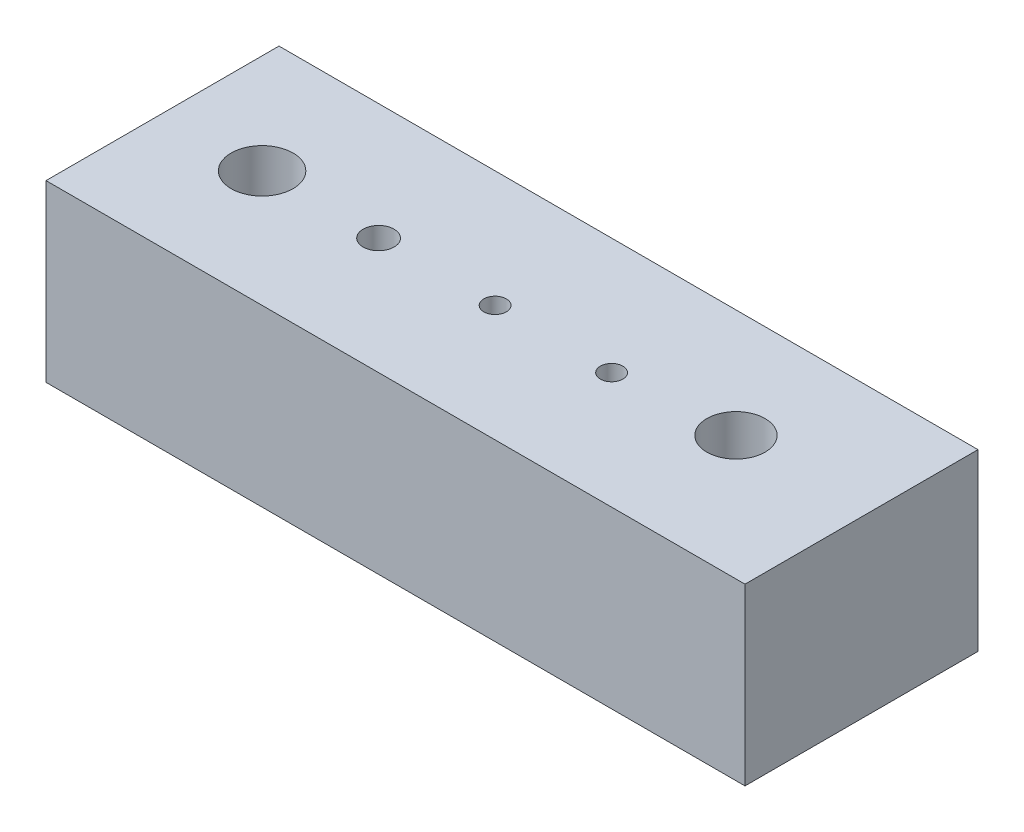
SolidWorks part; units mm, degrees
ref_plane "Front Plane" through (0, 0, 0) normal (0, 0, 1) x (1, 0, 0)
ref_plane "Top Plane" through (0, 0, 0) normal (0, 1, 0) x (1, 0, 0)
ref_plane "Right Plane" through (0, 0, 0) normal (1, 0, 0) x (0, 0, -1)
sketch "Sketch1" plane through (0, 0, 0) normal (0, 1, 0) x (1, 0, 0)
  line L1 (0, 0) -> (152.4, 0)
  line L2 (0, 0) -> (0, 50.8)
  line L3 (0, 50.8) -> (152.4, 50.8)
  line L4 (152.4, 0) -> (152.4, 50.8)
  dimension "D1" = 152.4
  dimension "D2" = 50.8
extrude "Boss-Extrude1" add sketch "Sketch1" along normal blind 38.1
hole_wizard "1/2 Clearance Hole2" positions "Sketch6" profile "Sketch5" hole size "1/2" standard "ANSI Inch"
sketch "Sketch6" plane through (0, 38.1, 0) normal (0, 1, 0) x (1, 0, 0)
  line L0 (0, 50.8) -> (0, 0) construction
  line L1 (152.4, 50.8) -> (0, 50.8) construction
  point P0 (21.717, 25.4)
  point P1 (0, 25.4)
  dimension "D1" = 21.717
  dimension "D2" = 25.4
sketch "Sketch5" plane through (21.717, 38.1, -25.4) normal (1, 0, 0) x (0, 0, 1)
  line L0 (0, 0) -> (0, 38.1)
  line L1 (0, 38.1) -> (6.7462, 38.1)
  line L2 (6.7462, 38.1) -> (6.7462, 0)
  line L5 (6.7462, 0) -> (0, 0)
  line L11 (0, -6.35) -> (0, 107.95) construction
  dimension "Thru Hole Dia." = 13.4925
  dimension "Thru Hole Depth" = 38.1
hole_wizard "1/4 Clearance Hole1" positions "Sketch15" profile "Sketch14" hole size "1/4" standard "ANSI Inch"
sketch "Sketch15" plane through (0, 38.1, 0) normal (0, 1, 0) x (1, 0, 0)
  line L0 (152.4, 50.8) -> (0, 50.8) construction
  circle A0 centre (21.717, 25.4) radius 6.7462 construction
  point P0 (47.117, 25.4)
  dimension "D1" = 25.4
  dimension "D2" = 25.4
sketch "Sketch14" plane through (47.117, 38.1, -25.4) normal (1, 0, 0) x (0, 0, 1)
  line L0 (0, 0) -> (0, 40.1298)
  line L1 (0, 40.1298) -> (3.3782, 38.1)
  line L2 (3.3782, 38.1) -> (3.3782, 0)
  line L5 (3.3782, 0) -> (0, 0)
  line L10 (0, 40.1298) -> (-3.3782, 38.1) construction
  line L11 (0, -6.35) -> (0, 107.95) construction
  dimension "Hole Dia." = 6.7564
  dimension "Hole Depth" = 38.1
  dimension "Drill Angle" = 118
hole_wizard "#10 (0.1935) Diameter Hole1" positions "Sketch13" profile "Sketch12" hole size "#10" standard "ANSI Inch"
sketch "Sketch13" plane through (0, 38.1, 0) normal (0, 1, 0) x (1, 0, 0)
  line L0 (152.4, 50.8) -> (0, 50.8) construction
  circle A0 centre (47.117, 25.4) radius 3.3782 construction
  point P0 (72.517, 25.4)
  dimension "D1" = 25.4
  dimension "D2" = 25.4
sketch "Sketch12" plane through (72.517, 38.1, -25.4) normal (1, 0, 0) x (0, 0, 1)
  line L0 (0, 0) -> (0, 39.5766)
  line L1 (0, 39.5766) -> (2.4574, 38.1)
  line L2 (2.4574, 38.1) -> (2.4574, 0)
  line L5 (2.4574, 0) -> (0, 0)
  line L10 (0, 39.5766) -> (-2.4575, 38.1) construction
  line L11 (0, -6.35) -> (0, 107.95) construction
  dimension "Hole Dia." = 4.9149
  dimension "Hole Depth" = 38.1
  dimension "Drill Angle" = 118
hole_wizard "#10 (0.1935) Diameter Hole2" positions "Sketch9" profile "Sketch7" hole size "#10" standard "ANSI Inch"
sketch "Sketch9" plane through (0, 38.1, 0) normal (0, 1, 0) x (1, 0, 0)
  line L0 (152.4, 50.8) -> (0, 50.8) construction
  circle A0 centre (72.517, 25.4) radius 2.4574 construction
  point P0 (97.917, 25.4)
  dimension "D1" = 25.4
  dimension "D2" = 25.4
sketch "Sketch7" plane through (97.917, 38.1, -25.4) normal (1, 0, 0) x (0, 0, 1)
  line L0 (0, 0) -> (0, 39.5766)
  line L1 (0, 39.5766) -> (2.4574, 38.1)
  line L2 (2.4574, 38.1) -> (2.4574, 0)
  line L5 (2.4574, 0) -> (0, 0)
  line L10 (0, 39.5766) -> (-2.4575, 38.1) construction
  line L11 (0, -6.35) -> (0, 107.95) construction
  dimension "Hole Dia." = 4.9149
  dimension "Hole Depth" = 38.1
  dimension "Drill Angle" = 118
hole_wizard "1/2 (0.5) Diameter Hole1" positions "Sketch11" profile "Sketch10" hole size "1/2" standard "ANSI Inch"
sketch "Sketch11" plane through (0, 38.1, 0) normal (0, 1, 0) x (1, 0, 0)
  circle A0 centre (97.917, 25.4) radius 2.4574 construction
  point P0 (123.317, 27.1142)
  dimension "D1" = 25.4
sketch "Sketch10" plane through (123.317, 38.1, -27.1142) normal (1, 0, 0) x (0, 0, 1)
  line L0 (0, 0) -> (0, 41.9155)
  line L1 (0, 41.9155) -> (6.35, 38.1)
  line L2 (6.35, 38.1) -> (6.35, 0)
  line L5 (6.35, 0) -> (0, 0)
  line L10 (0, 41.9155) -> (-6.35, 38.1) construction
  line L11 (0, -6.35) -> (0, 107.95) construction
  dimension "Hole Dia." = 12.7
  dimension "Hole Depth" = 38.1
  dimension "Drill Angle" = 118
